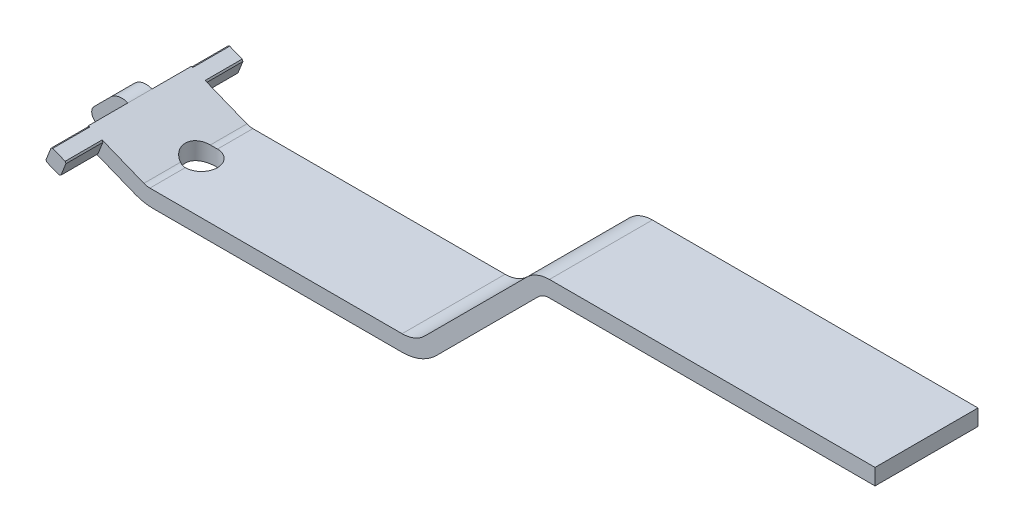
SolidWorks part; units mm, degrees
ref_plane "Plan de face" through (0, 0, 0) normal (0, 0, 1) x (1, 0, 0)
ref_plane "Plan de dessus" through (0, 0, 0) normal (0, 1, 0) x (1, 0, 0)
ref_plane "Plan de droite" through (0, 0, 0) normal (1, 0, 0) x (0, 0, -1)
sketch "Esquisse1" plane through (0, 0, 0) normal (0, 0, 1) x (1, 0, 0)
  line L0 (0, 0) -> (3.2496, -1.3) construction
  line L1 (3.2496, -1.3) -> (20.2496, -1.3) construction
  line L2 (3.3459, -0.8) -> (20.0425, -0.8) construction
  line L3 (-0.1857, -0.4642) -> (3.1533, -1.8)
  line L4 (3.1533, -1.8) -> (19.2141, -1.8)
  line L5 (20.2496, -1.3) -> (27.7496, 6.2) construction
  line L6 (0.1857, 0.4642) -> (3.3459, -0.8)
  line L7 (3.3459, -0.8) -> (19.2141, -0.8)
  line L8 (21.3354, -0.9213) -> (27.6638, 5.4071)
  line L9 (20.6283, -0.2142) -> (26.9567, 6.1142)
  line L10 (-0.1857, -0.4642) -> (3.1533, -1.8) construction
  line L11 (0.1857, 0.4642) -> (-0.2785, 0.6499)
  line L12 (-0.2785, 0.6499) -> (-0.6499, -0.2785)
  line L13 (-0.6499, -0.2785) -> (-0.1857, -0.4642)
  line L14 (0.5, 0.3385) -> (0.5, -0.7385) construction
  line L15 (20.0425, -0.8) -> (36.7254, 15.8829) construction
  line L16 (20.4567, -1.8) -> (37.4325, 15.1758) construction
  line L17 (20.2496, -1.3) -> (37.0789, 15.5293) construction
  line L18 (28.3709, 5.7) -> (48.6062, 5.7)
  line L19 (20.6032, -1.6536) -> (28.1032, 5.8464) construction
  line L20 (3.1533, -1.8) -> (20.4567, -1.8) construction
  line L21 (19.8961, -0.9464) -> (27.3961, 6.5536) construction
  line L22 (27.7496, 6.2) -> (48.6062, 6.2) construction
  line L23 (28.3709, 6.7) -> (48.6062, 6.7)
  line L24 (27.7496, 6.7) -> (48.6062, 6.7) construction
  line L25 (27.7496, 5.7) -> (48.6062, 5.7) construction
  line L26 (48.6062, 6.7) -> (48.6062, 5.7)
  arc A0 (0.1857, 0.4642) -> (-0.1857, -0.4642) centre (0, 0) ccw construction
  circle A1 centre (0, 0) radius 0.65 construction
  arc A2 (19.2141, -0.8) -> (20.6283, -0.2142) centre (19.2141, 1.2) ccw
  arc A3 (19.2141, -1.8) -> (21.3354, -0.9213) centre (19.2141, 1.2) ccw
  arc A4 (28.3709, 6.7) -> (26.9567, 6.1142) centre (28.3709, 4.7) ccw
  arc A5 (27.6638, 5.4071) -> (28.3709, 5.7) centre (28.3709, 4.7) cw
  dimension "D4" = 0.5
  dimension "D7" = 1.3
  dimension "D11" = 2
  dimension "D12" = 3
  dimension "D15" = 2
  dimension "D16" = 1
  dimension "D1" = 3.5
  dimension "D2" = 17
  dimension "D3" = 135
  dimension "D9" = 1.8
  dimension "D10" = 7.5
  dimension "D17" = 49
  dimension "D5" = 0.5
  dimension "D6" = 0.5
  dimension "D8" = 0.5
  dimension "D13" = 0.5
  dimension "D14" = 0.5
extrude "Boss.-Extru.1" add sketch "Esquisse1" along normal mid plane 6.4
sketch "Esquisse2" plane through (0, 0, 0) normal (0, 0, 1) x (1, 0, 0)
  line L0 (-0.2785, 0.6499) -> (-0.6499, -0.2785) construction
  line L2 (-0.2785, 0.6499) -> (-0.6499, -0.2785)
  line L3 (0.6499, 0.2785) -> (0.2785, -0.6499)
  line L4 (-0.2785, 0.6499) -> (0.6499, 0.2785)
  line L5 (-0.6499, -0.2785) -> (0.2785, -0.6499)
  line L7 (-0.6499, -0.2785) -> (3.1533, -1.8) construction
extrude "Boss.-Extru.2" add sketch "Esquisse2" along normal mid plane 11
sketch "Esquisse3" plane through (0, 0, 5.5) normal (0, 0, 1) x (1, 0, 0)
  circle A0 centre (0, 0) radius 0.65
  dimension "D1" = 1.3
extrude "Enlèv. mat.-Extru.1" cut sketch "Esquisse3" against normal up to surface (2.3 mm away) flip side to cut
sketch "Esquisse4" plane through (0, 0, -5.5) normal (0, 0, -1) x (-1, 0, 0)
  circle A0 centre (0, 0) radius 0.65 construction
  circle A1 centre (0, 0) radius 0.65
extrude "Enlèv. mat.-Extru.2" cut sketch "Esquisse4" against normal up to surface (2.3 mm away) flip side to cut
sketch "Esquisse6" plane through (0, 0, 0) normal (0, 0, 1) x (1, 0, 0)
  line L0 (-0.6499, -0.2785) -> (-1.675, -1.3036)
  line L2 (-2.3821, -0.5964) -> (-1.3571, 0.4286)
  line L3 (-0.4642, 0.1857) -> (1.5431, 0.1857) construction
  line L7 (-0.2785, 0.6499) -> (-0.6499, -0.2785) construction
  line L8 (-0.2785, 0.6499) -> (-0.6499, -0.2785)
  line L9 (-2.0285, -0.95) -> (-2.0878, -2.0756) construction
  arc A0 (-0.2785, 0.6499) -> (-1.3571, 0.4286) centre (-0.6499, -0.2785) ccw
  arc A1 (-2.3821, -0.5964) -> (-1.675, -1.3036) centre (-2.0285, -0.95) ccw
  point P1 (-1.9768, -1.9768)
  point P4 (-2.6839, -1.2697)
  dimension "D1" = 135
  dimension "D2" = 0.95
extrude "Boss.-Extru.3" add sketch "Esquisse6" along normal mid plane 1.5
fillet "Congé1" radius 3 1 edges at (3.1533, -1.8, 0)
fillet "Congé2" radius 1 1 edges at (3.3459, -0.8, 0)
sketch "Esquisse7" plane through (0, -0.8, 0) normal (0, 1, 0) x (1, 0, 0)
  line L0 (3.5385, 3.2) -> (3.5385, -3.2) construction
  circle A0 centre (3.5385, 0) radius 1
  dimension "D1" = 2
extrude "Enlèv. mat.-Extru.3" cut sketch "Esquisse7" against normal through all and the other way through all
